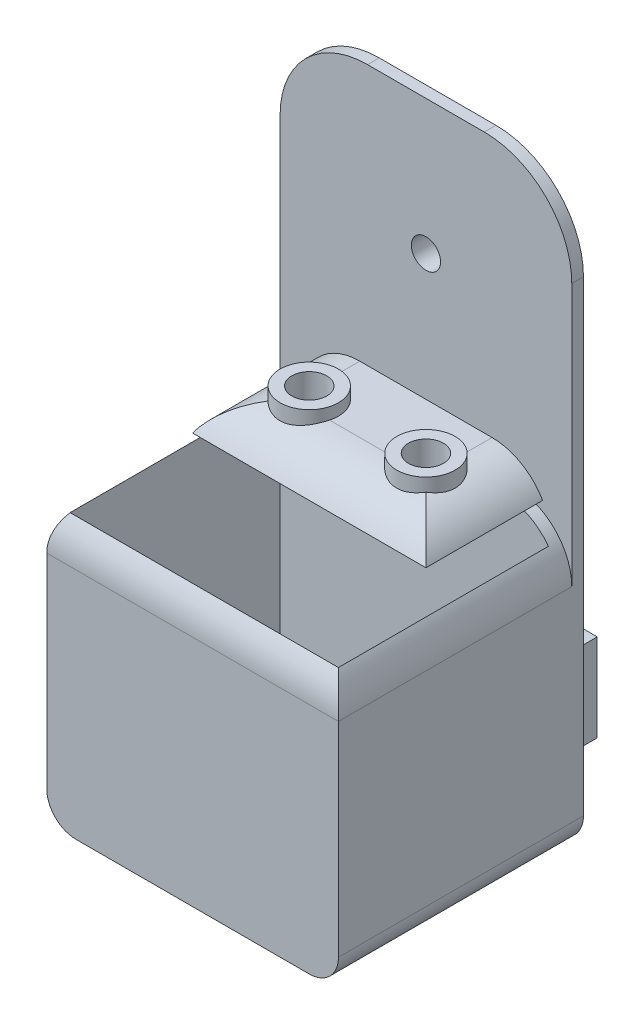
SolidWorks part; units mm, degrees
ref_plane "Front Plane" through (0, 0, 0) normal (0, 0, 1) x (1, 0, 0)
ref_plane "Top Plane" through (0, 0, 0) normal (0, 1, 0) x (1, 0, 0)
ref_plane "Right Plane" through (0, 0, 0) normal (1, 0, 0) x (0, 0, -1)
sketch "Sketch1" plane through (0, 0, 0) normal (0, 0, 1) x (1, 0, 0)
  line L1 (-10, 50) -> (10, 50)
  line L2 (-25, 35) -> (-25, -45)
  line L3 (-20, -50) -> (20, -50)
  line L4 (25, 35) -> (25, -45)
  line L5 (-25, 50) -> (25, -50) construction
  line L6 (-25, -50) -> (25, 50) construction
  arc A0 (25, -45) -> (20, -50) centre (20, -45) cw
  arc A1 (-20, -50) -> (-25, -45) centre (-20, -45) cw
  arc A2 (25, 35) -> (10, 50) centre (10, 35) ccw
  arc A3 (-25, 35) -> (-10, 50) centre (-10, 35) cw
  point P0 (0, 0)
  dimension "D3" = 5
  dimension "D4" = 15
  dimension "D1" = 100
  dimension "D2" = 50
extrude "Boss-Extrude1" add sketch "Sketch1" along normal blind 2
sketch "Sketch2" plane through (0, 0, 2) normal (0, 0, 1) x (1, 0, 0)
  line L0 (0, 0) -> (25, 0)
  line L1 (25, -45) -> (25, 35) construction
  line L2 (25, 0) -> (-25, 0)
  line L3 (-25, 35) -> (-25, -45) construction
extrude "Boss-Extrude2" add sketch "Sketch2" along normal blind 40 contours L0 L2 M6 M7 M8 M1 M2
sketch "Sketch3" plane through (0, 0, 0) normal (0, 1, 0) x (1, 0, 0)
  line L0 (0, -2) -> (0, -42) construction
  line L1 (-25, -2) -> (25, -2) construction
  line L2 (-25, -42) -> (25, -42) construction
  line L4 (-23, -4) -> (23, -4)
  line L5 (-23, -4) -> (-23, -40)
  line L6 (-23, -40) -> (23, -40)
  line L7 (23, -4) -> (23, -40)
  line L8 (-23, -4) -> (23, -40) construction
  line L9 (-23, -40) -> (23, -4) construction
  point P6 (0, -22)
  dimension "D1" = 36
  dimension "D2" = 46
extrude "Cut-Extrude1" cut sketch "Sketch3" against normal blind 48 contours L5 L4 L7 L6
fillet "Fillet8" radius 10 3 edges at (-25, 0, 22) (25, 0, 22) (0, 0, 42)
sketch "Sketch4" plane through (0, 0, 2) normal (0, 0, 1) x (1, 0, 0)
  line L0 (25, 2.8108) -> (-25, 2.8108) construction
  line L1 (25, -10) -> (25, 35) construction
  line L2 (-25, 35) -> (-25, -10) construction
  line L4 (-20, 0.3108) -> (20, 0.3108)
  line L5 (-20, 0.3108) -> (-20, 5.3108)
  line L6 (-20, 5.3108) -> (20, 5.3108)
  line L7 (20, 0.3108) -> (20, 5.3108)
  line L8 (-20, 0.3108) -> (20, 5.3108) construction
  line L9 (-20, 5.3108) -> (20, 0.3108) construction
  point P6 (0, 2.8108)
  dimension "D1" = 5
  dimension "D2" = 40
extrude "Boss-Extrude3" add sketch "Sketch4" along normal blind 20
sketch "Sketch5" plane through (0, 5.3108, 0) normal (0, 1, 0) x (1, 0, 0)
  circle A0 centre (-10, -12) radius 5
  circle A1 centre (10, -12) radius 5
extrude "Boss-Extrude6" add sketch "Sketch5" along normal blind 2
sketch "Sketch6" plane through (0, 7.3108, 0) normal (0, 1, 0) x (1, 0, 0)
  circle A0 centre (-10, -12) radius 3
  circle A1 centre (10, -12) radius 3
extrude "Cut-Extrude2" cut sketch "Sketch6" against normal blind 7 contours A0 | A1
fillet "Fillet13" radius 10 3 edges at (-20, 5.3108, 12) (0, 5.3108, 22) (20, 5.3108, 12)
sketch "Sketch7" plane through (0, 0, 0) normal (0, 0, -1) x (-1, 0, 0)
  line L0 (-25, 26.5553) -> (25, 26.5553) construction
  line L1 (-25, -45) -> (-25, 35) construction
  line L2 (25, 35) -> (25, -45) construction
  line L3 (-25, -36.9446) -> (25, -36.9446) construction
  line L5 (-5, 34.0553) -> (5, 34.0553)
  line L6 (-5, 34.0553) -> (-5, 19.0553)
  line L7 (-5, 19.0553) -> (5, 19.0553)
  line L8 (5, 34.0553) -> (5, 19.0553)
  line L9 (-5, 34.0553) -> (5, 19.0553) construction
  line L10 (-5, 19.0553) -> (5, 34.0553) construction
  point P8 (0, 26.5553)
  dimension "D1" = 15
  dimension "D2" = 10
extrude "Boss-Extrude8" add sketch "Sketch7" along normal blind 8
sketch "Sketch8" plane through (0, 0, -8) normal (0, 0, -1) x (-1, 0, 0)
  circle A0 centre (0, 26.9677) radius 2.5
extrude "Cut-Extrude4" cut sketch "Sketch8" against normal blind 10
sketch "Sketch9" plane through (0, 0, 0) normal (0, 0, -1) x (-1, 0, 0)
  line L0 (-25, -32.7629) -> (25, -32.7629) construction
  line L1 (-25, -45) -> (-25, 35) construction
  line L2 (25, 35) -> (25, -45) construction
  line L4 (-19.3645, -25.2629) -> (-9.3645, -25.2629)
  line L5 (-19.3645, -25.2629) -> (-19.3645, -40.2629)
  line L6 (-19.3645, -40.2629) -> (-9.3645, -40.2629)
  line L7 (-9.3645, -25.2629) -> (-9.3645, -40.2629)
  line L8 (-19.3645, -25.2629) -> (-9.3645, -40.2629) construction
  line L9 (-19.3645, -40.2629) -> (-9.3645, -25.2629) construction
  line L10 (8.4567, -25.2629) -> (18.4567, -25.2629)
  line L11 (8.4567, -25.2629) -> (8.4567, -40.2629)
  line L12 (8.4567, -40.2629) -> (18.4567, -40.2629)
  line L13 (18.4567, -25.2629) -> (18.4567, -40.2629)
  line L14 (8.4567, -25.2629) -> (18.4567, -40.2629) construction
  line L15 (8.4567, -40.2629) -> (18.4567, -25.2629) construction
  point P6 (-14.3645, -32.7629)
  point P11 (13.4567, -32.7629)
  dimension "D1" = 15
  dimension "D2" = 10
  dimension "D3" = 15
  dimension "D4" = 10
extrude "Boss-Extrude9" add sketch "Sketch9" along normal blind 8 separate body
